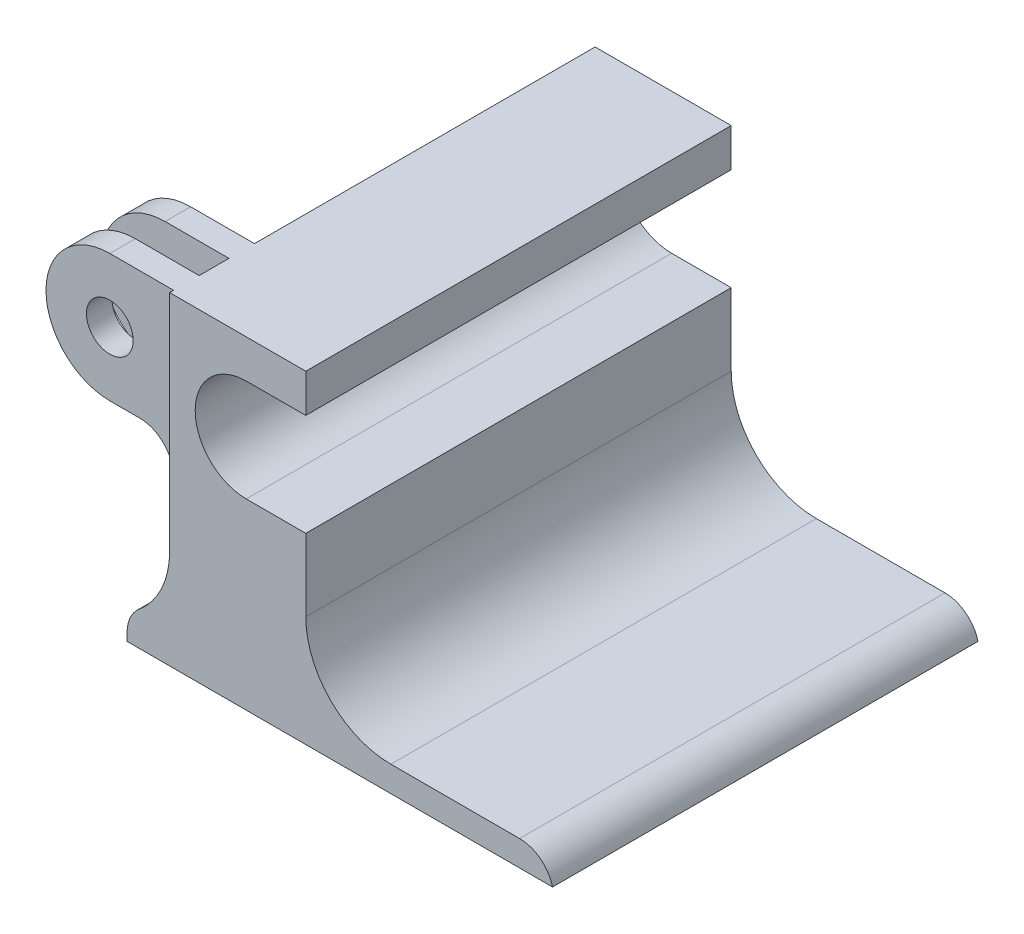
SolidWorks part; units mm, degrees
ref_plane "Plan de face" through (0, 0, 0) normal (0, 0, 1) x (1, 0, 0)
ref_plane "Plan de dessus" through (0, 0, 0) normal (0, 1, 0) x (1, 0, 0)
ref_plane "Plan de droite" through (0, 0, 0) normal (1, 0, 0) x (0, 0, -1)
sketch "Esquisse1" plane through (0, 0, 0) normal (0, 1, 0) x (1, 0, 0)
  line L0 (0, 0) -> (0, -7.3877) construction
  line L1 (-25, 24.7807) -> (25, 24.7807)
  line L2 (-25, 24.7807) -> (-25, -25.2193)
  line L3 (-25, -25.2193) -> (25, -25.2193)
  line L4 (25, 24.7807) -> (25, -25.2193)
  line L5 (0, 0) -> (50, 0) construction
  dimension "D1" = 50
  dimension "D2" = 50
extrude "Boss.-Extru.1" add sketch "Esquisse1" along normal blind 3
sketch "Esquisse2" plane through (0, 3, 0) normal (0, 1, 0) x (1, 0, 0)
  line L0 (25, 24.7807) -> (-25, 24.7807) construction
  line L1 (-20, 24.7807) -> (-4, 24.7807)
  line L2 (-20, 24.7807) -> (-20, -25.2193)
  line L3 (-20, -25.2193) -> (-4, -25.2193)
  line L4 (-4, 24.7807) -> (-4, -25.2193)
  line L5 (-25, -25.2193) -> (25, -25.2193) construction
  line L6 (-25, 24.7807) -> (-25, -25.2193) construction
  dimension "D1" = 5
  dimension "D2" = 16
extrude "Boss.-Extru.2" add sketch "Esquisse2" along normal blind 35
sketch "Esquisse3" plane through (0, 0, 25.2193) normal (0, 0, 1) x (1, 0, 0)
  line L0 (-20, 38) -> (-20, 3) construction
  line L1 (-4, 3) -> (25, 3) construction
  circle A0 centre (-11, 27.5) radius 6
  dimension "D1" = 12
  dimension "D2" = 9
  dimension "D3" = 24.5
extrude "Enlèv. mat.-Extru.1" cut sketch "Esquisse3" against normal through all
sketch "Esquisse4" plane through (0, 0, 25.2193) normal (0, 0, 1) x (1, 0, 0)
  line L0 (-11, 33.5) -> (-4, 33.5)
  line L1 (-4, 38) -> (-4, 3) construction
  line L2 (-11, 33.5) -> (-11, 21.5)
  line L3 (-11, 21.5) -> (-4, 21.5)
  line L4 (-4, 21.5) -> (-4, 33.5)
  circle A0 centre (-11, 27.5) radius 6 construction
sketch "Esquisse13" plane through (0, 0, 25.2193) normal (0, 0, 1) x (1, 0, 0)
  line L0 (-11, 33.5) -> (-11, 21.5)
  line L1 (-11, 21.5) -> (0, 21.5)
  line L2 (0, 21.5) -> (0, 33.5)
  line L3 (0, 33.5) -> (-11, 33.5)
  circle A0 centre (-11, 27.5) radius 6 construction
extrude "Enlèv. mat.-Extru.3" cut sketch "Esquisse13" against normal through all
sketch "Esquisse14" plane through (-20, 0, 0) normal (-1, 0, 0) x (0, 0, 1)
  line L0 (-24.7807, 38) -> (25.2193, 38) construction
  line L1 (15.25, 38) -> (18.25, 38)
  line L2 (15.25, 38) -> (15.25, 23)
  line L3 (15.25, 23) -> (18.25, 23)
  line L4 (18.25, 38) -> (18.25, 23)
  line L5 (0, 0) -> (0, 10.5886) construction
  line L6 (21.75, 38) -> (24.75, 38)
  line L7 (21.75, 38) -> (21.75, 23)
  line L8 (21.75, 23) -> (24.75, 23)
  line L9 (24.75, 38) -> (24.75, 23)
  dimension "D1" = 3
  dimension "D2" = 3.5
  dimension "D3" = 15
  dimension "D4" = 15.25
extrude "Boss.-Extru.8" add sketch "Esquisse14" along normal blind 15
fillet "Congé7" radius 7.5 4 edges at (-35, 23, 23.25) (-35, 38, 23.25) (-35, 38, 16.75) (-35, 23, 16.75)
fillet "Congé8" radius 4 2 edges at (-20, 23, 23.25) (-20, 23, 16.75)
fillet "Congé9" radius 10 1 edges at (-4, 3, 0.2193)
fillet "Congé10" radius 10 1 edges at (-20, 3, 0.2193)
fillet "Congé11" radius 4 1 edges at (-25, 3, 0.2193)
fillet "Congé12" radius 4 1 edges at (25, 3, 0.2193)
sketch "Esquisse19" plane through (0, 0, 24.75) normal (0, 0, 1) x (1, 0, 0)
  line L0 (-27.5, 38) -> (-20, 38) construction
  line L1 (-20, 19) -> (-20, 38) construction
  circle A0 centre (-27.5, 30.5) radius 2.75
  dimension "D1" = 5.5
  dimension "D2" = 7.5
  dimension "D3" = 7.5
extrude "Enlèv. mat.-Extru.4" cut sketch "Esquisse19" against normal through all
extrude "Enlèv. mat.-Extru.2" cut sketch "Esquisse4" against normal through all
fillet "Congé1" radius 15
sketch "Esquisse6" plane through (0, 41, 0) normal (0, 1, 0) x (1, 0, 0)
  line L0 (-24, 24.7807) -> (-24, -25.2193) construction
  line L1 (-24, 15.25) -> (-6, 15.25)
  line L2 (-24, 15.25) -> (-24, 18.25)
  line L3 (-24, 18.25) -> (-6, 18.25)
  line L4 (-6, 15.25) -> (-6, 18.25)
  line L5 (-6, -25.2193) -> (-6, 24.7807) construction
  line L6 (0, 0) -> (-11.5513, 0) construction
  line L8 (-24, 21.75) -> (-6, 21.75)
  line L9 (-24, 21.75) -> (-24, 24.75)
  line L10 (-24, 24.75) -> (-6, 24.75)
  line L11 (-6, 21.75) -> (-6, 24.75)
  dimension "D1" = 3.5
  dimension "D2" = 15.25
  dimension "D3" = 3
  dimension "D4" = 3
sketch "Esquisse7" plane through (0, 41, 0) normal (0, 1, 0) x (1, 0, 0)
